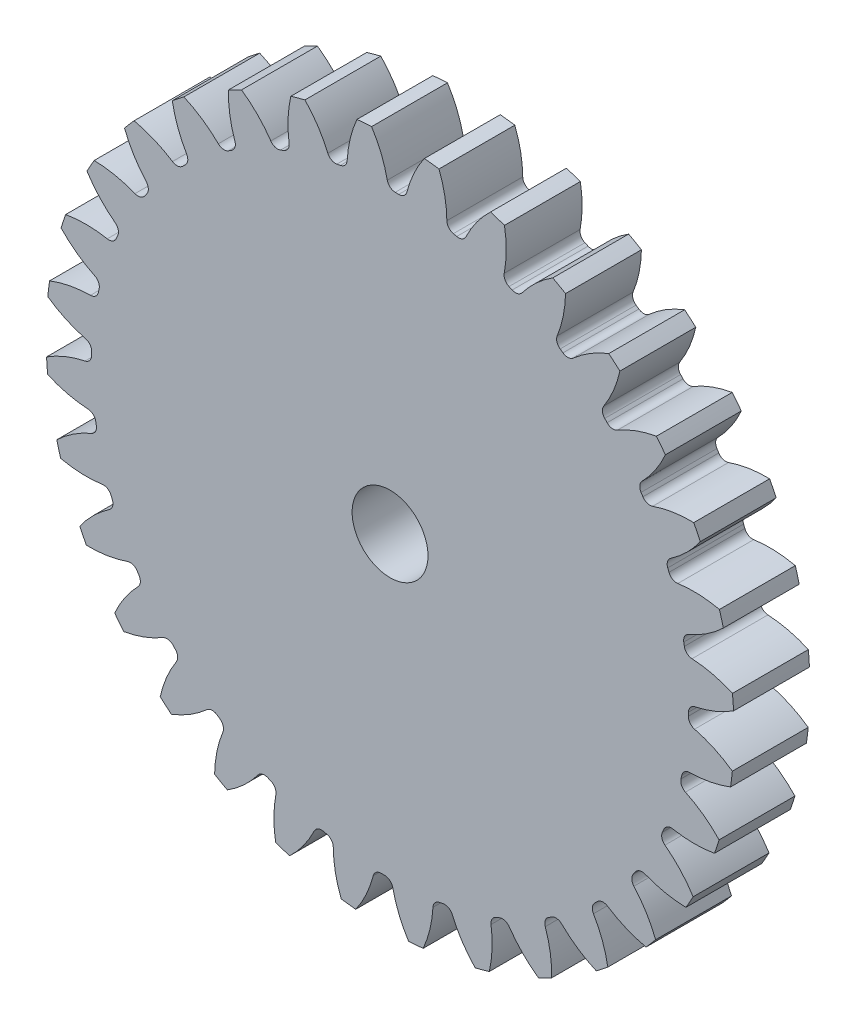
SolidWorks part; units mm, degrees
ref_plane "Front" through (0, 0, 0) normal (0, 0, 1) x (1, 0, 0)
ref_plane "Top" through (0, 0, 0) normal (0, 1, 0) x (1, 0, 0)
ref_plane "Right" through (0, 0, 0) normal (1, 0, 0) x (0, 0, -1)
sketch "Sketch3" plane through (0, 0, 0) normal (0, 0, 1) x (1, 0, 0)
  circle A0 centre (0, 0) radius 575.7333
  dimension "od" = 1151.4667
extrude "gearBody" add sketch "Sketch3" along normal blind 127
sketch "Sketch2" plane through (0, 0, 0) normal (0, 0, 1) x (1, 0, 0)
  line L0 (0, 0) -> (470.4285, 194.8579) construction
  line L1 (573.6644, -58.0188) -> (0, 0) construction
  line L2 (0, 0) -> (36.3143, 0) construction
  line L3 (541.6864, 13.9753) -> (540.4611, -39.0038) construction
  line L5 (541.0738, -12.5142) -> (0, 0) construction
  line L7 (0, 0) -> (509.1881, 0) construction
  arc A0 (509.1696, 4.3446) -> (508.4243, -27.88) centre (0, 0) ccw construction
  arc A1 (574.9034, 30.903) -> (572.8599, -57.4491) centre (0, 0) ccw construction
  arc A2 (541.6864, 13.9753) -> (540.4611, -39.0038) centre (0, 0) ccw construction
  arc A3 (499.3243, -14.45) -> (499.4584, -8.6503) centre (0, 0) ccw
  arc A4 (573.6644, -58.0188) -> (509.6473, -28.1925) centre (460.9167, -216.3985) ccw
  arc A5 (573.6644, -58.0188) -> (575.7333, 31.4349) centre (0, 0) ccw
  arc A6 (575.7333, 31.4349) -> (510.4057, 4.6001) centre (470.4285, 194.8579) cw
  arc A7 (499.4584, -8.6503) -> (510.4057, 4.6001) centre (513.2401, -8.889) cw
  arc A8 (509.6473, -28.1925) -> (499.3243, -14.45) centre (513.1023, -14.8487) cw
  point P6 (575.7333, 31.4349)
  point P22 (573.6644, -58.0188)
  dimension "baseDia" = 1018.3762
  dimension "od" = 1151.4667
  dimension "pd" = 1083.7333
  dimension "rd" = 999.0667
  dimension "rFillet" = 13.7837
  dimension "pointX" = 575.7333
  dimension "pointY" = 31.4349
  dimension "CTT" = 52.9791
  dimension "flankCenterAngle" = 22.5
extrude "toothCut" cut sketch "Sketch2" along normal through all
pattern_circular "CirPattern1" count 32 over 360 about axis through (0, 0, 0) along (0, 0, 1) of "toothCut"
sketch "hub1Dia" plane through (0, 0, 0) normal (0, 0, -1) x (-1, 0, 0)
  circle A0 centre (0, 0) radius 12.7
  dimension "hub1Dia" = 25.4
sketch "hub2Dia" plane through (0, 0, 127) normal (0, 0, 1) x (1, 0, 0)
  circle A0 centre (0, 0) radius 12.7
  dimension "hub2dia" = 25.4
sketch "boreDia" plane through (0, 0, 0) normal (0, 0, 1) x (1, 0, 0)
  circle A0 centre (0, 0) radius 63.5
  dimension "boreDia" = 127
extrude "bore" cut sketch "boreDia" against normal mid plane 25400
